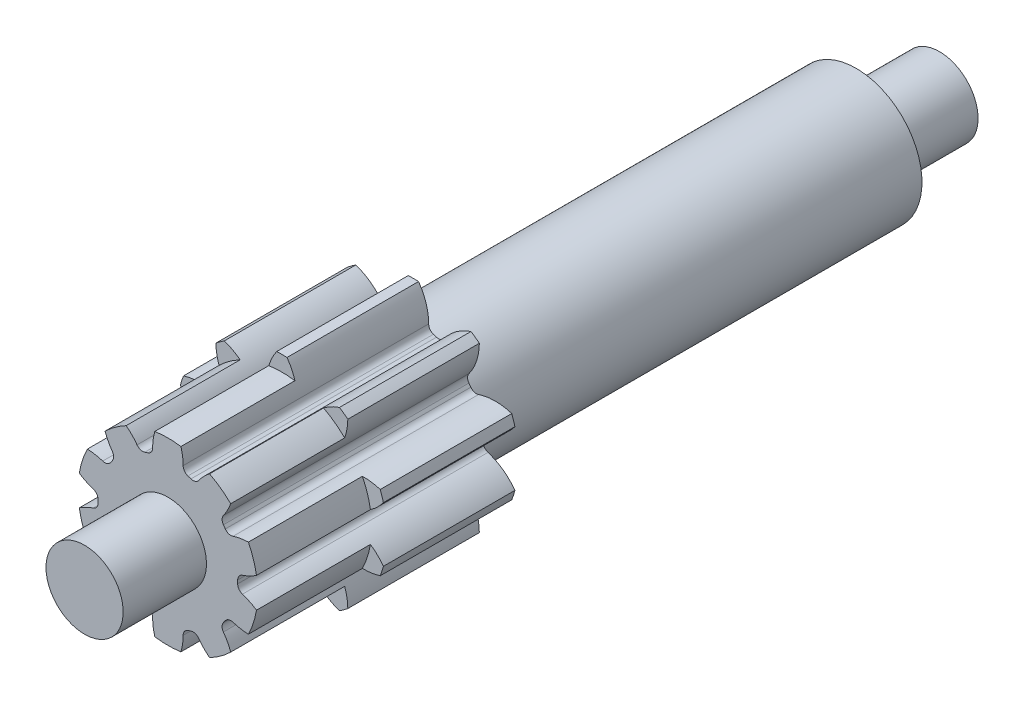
SolidWorks part; units mm, degrees
ref_plane "Front Plane" through (0, 0, 0) normal (0, 0, 1) x (1, 0, 0)
ref_plane "Top Plane" through (0, 0, 0) normal (0, 1, 0) x (1, 0, 0)
ref_plane "Right Plane" through (0, 0, 0) normal (1, 0, 0) x (0, 0, -1)
sketch "Sketch1" plane through (0, 0, 0) normal (0, 0, 1) x (1, 0, 0)
  line L0 (0, 0) -> (0, 1) construction
  line L1 (-0.3214, 1.117) -> (0.3214, 0.883) construction
  circle A0 centre (0, 0) radius 0.8 construction
  circle A1 centre (0, 0) radius 1.2 construction
  circle A2 centre (0, 0) radius 1 construction
  circle A3 centre (0, 0) radius 0.9397 construction
  circle A5 centre (0, 0) radius 0.5 construction
  point P8 (0.1, 0)
  point P13 (5, 0)
sketch "Sketch2" plane through (0, 0, 0) normal (1, 0, 0) x (0, 0, -1)
  line L0 (-4.875, 0) -> (4.875, 0) construction
  line L1 (4.875, 1.2) -> (4.875, -1.2) construction
  line L3 (-4.875, 1.2) -> (4.875, 1.2) construction
  line L5 (-4.875, 12.5) -> (-4.875, -12.5) construction
  point P2 (0, 1.2)
  dimension "Overall Width" = 9.75
  dimension "Face Width" = 4.875
sketch "Sketch3" plane through (0, 0, 0) normal (0, 0, 1) x (1, 0, 0)
  circle A0 centre (0, 0) radius 1.2
  circle A1 centre (0, 0) radius 1.2 construction
extrude "Boss-Extrude1" add sketch "Sketch3" against normal up to vertex (4.875 mm away) and the other way up to vertex (4.875 mm away)
sketch "Sketch4" plane through (0, 0, 0) normal (0, 0, 1) x (1, 0, 0)
  line L0 (0.7961, -0.0785) -> (0.7961, 0.0785)
  arc A3 (1.1581, 0.3145) -> (1.1581, -0.3145) centre (0, 0) cw
  circle A4 centre (0, 0) radius 1.2 construction
  arc A5 (1.1581, 0.3145) -> (0.7961, 0.0785) centre (0.6623, 0.6793) cw
  circle A6 centre (0, 0) radius 0.8 construction
  arc A7 (1.1581, -0.3145) -> (0.7961, -0.0785) centre (0.6623, -0.6793) ccw
  spline S0 degree 4 poles (0.9302, 0.1332) (0.9306, 0.1332) (0.9319, 0.1334) (0.9341, 0.1339) (0.9378, 0.1349) (0.9425, 0.1363) (0.9484, 0.1382) (0.9553, 0.1409) (0.9629, 0.144) (0.971, 0.1477) (0.979, 0.1517) (0.9868, 0.1559) (0.9946, 0.1603) (1.0039, 0.1659) (1.0149, 0.1729) (1.0275, 0.1817) (1.0414, 0.1921) (1.0554, 0.2034) (1.0688, 0.215) (1.082, 0.2273) (1.0945, 0.2396) (1.1072, 0.2528) (1.1187, 0.2654) (1.1311, 0.28) (1.1411, 0.2921) (1.1562, 0.3118) (1.1625, 0.3205) (1.1719, 0.3338) (1.1749, 0.3384) knots 0 0 0 0 0 0.005377 0.015084 0.028532 0.04661 0.064855 0.092111 0.119476 0.146842 0.174209 0.201575 0.228941 0.256307 0.307035 0.361767 0.4165 0.471232 0.525964 0.580697 0.635429 0.690161 0.744894 0.799626 0.854358 0.909091 1 1 1 1 1 construction
  spline S1 degree 4 poles (0.9302, 0.1332) (0.9306, 0.1332) (0.9319, 0.1334) (0.9341, 0.1339) (0.9378, 0.1349) (0.9425, 0.1363) (0.9484, 0.1382) (0.9553, 0.1409) (0.9629, 0.144) (0.971, 0.1477) (0.979, 0.1517) (0.9868, 0.1559) (0.9946, 0.1603) (1.0039, 0.1659) (1.0149, 0.1729) (1.0275, 0.1817) (1.0414, 0.1921) (1.0554, 0.2034) (1.0688, 0.215) (1.082, 0.2273) (1.0945, 0.2396) (1.1072, 0.2528) (1.1187, 0.2654) (1.1311, 0.28) (1.1411, 0.2921) (1.1508, 0.3048) (1.1556, 0.3112) (1.1581, 0.3145) knots 0 0 0 0 0 0.005377 0.015084 0.028532 0.04661 0.064855 0.092111 0.119476 0.146842 0.174209 0.201575 0.228941 0.256307 0.307035 0.361767 0.4165 0.471232 0.525964 0.580697 0.635429 0.690161 0.744894 0.799626 0.854358 0.909091 0.909091 0.909091 0.909091 0.909091 construction
  spline S2 degree 4 poles (0.9302, -0.1332) (0.9306, -0.1332) (0.9319, -0.1334) (0.9341, -0.1339) (0.9378, -0.1349) (0.9425, -0.1363) (0.9484, -0.1382) (0.9553, -0.1409) (0.9629, -0.144) (0.971, -0.1477) (0.979, -0.1517) (0.9868, -0.1559) (0.9946, -0.1603) (1.0039, -0.1659) (1.0149, -0.1729) (1.0275, -0.1817) (1.0414, -0.1921) (1.0554, -0.2034) (1.0688, -0.215) (1.082, -0.2273) (1.0945, -0.2396) (1.1072, -0.2528) (1.1187, -0.2654) (1.1311, -0.28) (1.1411, -0.2921) (1.1562, -0.3118) (1.1625, -0.3205) (1.1719, -0.3338) (1.1749, -0.3384) knots 0 0 0 0 0 0.005377 0.015084 0.028532 0.04661 0.064855 0.092111 0.119476 0.146842 0.174209 0.201575 0.228941 0.256307 0.307035 0.361767 0.4165 0.471232 0.525964 0.580697 0.635429 0.690161 0.744894 0.799626 0.854358 0.909091 1 1 1 1 1 construction
  spline S3 degree 4 poles (0.9302, -0.1332) (0.9306, -0.1332) (0.9319, -0.1334) (0.9341, -0.1339) (0.9378, -0.1349) (0.9425, -0.1363) (0.9484, -0.1382) (0.9553, -0.1409) (0.9629, -0.144) (0.971, -0.1477) (0.979, -0.1517) (0.9868, -0.1559) (0.9946, -0.1603) (1.0039, -0.1659) (1.0149, -0.1729) (1.0275, -0.1817) (1.0414, -0.1921) (1.0554, -0.2034) (1.0688, -0.215) (1.082, -0.2273) (1.0945, -0.2396) (1.1072, -0.2528) (1.1187, -0.2654) (1.1311, -0.28) (1.1411, -0.2921) (1.1508, -0.3048) (1.1556, -0.3112) (1.1581, -0.3145) knots 0 0 0 0 0 0.005377 0.015084 0.028532 0.04661 0.064855 0.092111 0.119476 0.146842 0.174209 0.201575 0.228941 0.256307 0.307035 0.361767 0.4165 0.471232 0.525964 0.580697 0.635429 0.690161 0.744894 0.799626 0.854358 0.909091 0.909091 0.909091 0.909091 0.909091 construction
extrude "Cut-Extrude1" cut sketch "Sketch4" against normal through all both and the other way through all
fillet "Fillet1" radius 0.0785 2 edges at (0.7961, -0.0785, 0) (0.7961, 0.0785, 0)
pattern_circular "CirPattern1" count 10 over 360 about axis through (0, 0, 0) along (0, 0, 1) of "Cut-Extrude1", "Fillet1"
sketch "Sketch6" plane through (0, 0, 0) normal (0, 1, 0) x (1, 0, 0)
  line L0 (0, 6.2826) -> (0, -4.2534) construction
  line L1 (0, 4.875) -> (0, -4.875) construction
  line L2 (-0.44, 4.875) -> (-1.3, 4.875)
  line L3 (-1.3, 4.875) -> (-1.3, -1.125)
  line L4 (-1.3, -1.125) -> (-0.75, -1.125)
  line L5 (-0.75, -1.125) -> (-0.75, 3.925)
  line L6 (-0.75, 3.925) -> (-0.44, 3.925)
  line L7 (-0.44, 3.925) -> (-0.44, 4.875)
  line L8 (0.0587, 4.875) -> (-0.0587, 4.875) construction
  line L9 (-1.3, -2.625) -> (-1.3, -4.875)
  line L10 (-1.3, -4.875) -> (-0.44, -4.875)
  line L11 (-0.44, -4.875) -> (-0.44, -3.925)
  line L12 (-0.44, -3.925) -> (-1.025, -3.925)
  line L13 (-1.025, -3.925) -> (-1.025, -2.625)
  line L14 (-1.025, -2.625) -> (-1.3, -2.625)
  line L15 (0.0587, -4.875) -> (0.1741, -4.875) construction
  dimension "D1" = 0.88
  dimension "D2" = 1.5
  dimension "D3" = 2.6
  dimension "D4" = 6
  dimension "D5" = 0.95
  dimension "D6" = 2.05
  dimension "D7" = 1.5
  dimension "D8" = 0.95
revolve "Cut-Revolve1" cut sketch "Sketch6" angle 360 about L0
equation "\"Number of Teeth\"= 10"
equation "\"Module\"= 0.2"
equation "\"Diametral Pitch\"= 1 / \"Module\""
equation "\"Dedendum\"= 1.25 / \"Diametral Pitch\""
equation "\"Pitch Diameter\"= \"Module\" * \"Number of Teeth\""
equation "\"Root Diameter\"= \"Pitch Diameter\" - ( 2 * \"Dedendum\" ) + 0.1"
equation "\"Root Diameter@Sketch1\"=\"Root Diameter\""
equation "\"OD@Sketch1\" = \"Outside Diameter\""
equation "\"D1@CirPattern1\"=\"Number of Teeth\""
equation "\"Pressure Angle\"= 20"
equation "\"Base Diameter\"= \"Pitch Diameter\" * cos ( \"Pressure Angle\" )"
equation "\"Outside Diameter\"= ( \"Number of Teeth\" + 2 ) / \"Diametral Pitch\""
equation "\"Pitch Angle\"= 360deg / \"Number of Teeth\""
equation "\"Alpha\"= sqr ( \"Pitch Diameter\" ^ 2 - \"Base Diameter\" ^ 2 ) / \"Base Diameter\" * 180 / PI - \"Pressure Angle\""
equation "\"Beta\"= ( \"Pitch Angle\" / 4 - \"Alpha\" )"
equation "\"Phi\"= sqr ( ( \"Outside Diameter\" / 2 ) ^ 2 - ( \"Base Diameter\" / 2 ) ^ 2 ) / ( \"Base Diameter\" / 2 )"
equation "\"Addendum\"= 1 / \"Diametral Pitch\""
equation "\"WorkingDepth\"= 2 / \"Diametral Pitch\""
equation "\"WholeDepth\"= 2.25 / \"Diametral Pitch\""
equation "\"Clearance\"= 0.25 / \"Diametral Pitch\""
equation "\"ToothThickness\"= ( pi * 2 ) / \"Diametral Pitch\""
equation "\"CircularPitch\"= pi / \"Diametral Pitch\""
equation "\"Number of Teeth@Sketch1\"=\"Number of Teeth\""
equation "\"Module@Sketch1\"=\"Module\""
equation "\"Pressure Angle@Sketch1\"=\"Pressure Angle\""
equation "\"Gear Pitch Diameter@Sketch1\"=\"Pitch Diameter\""
equation "\"Base Diameter@Sketch1\"=\"Base Diameter\""
equation "\"Fillet\"= \"Clearance\" * cos ( \"Pressure Angle\" ) * tan ( ( 90 + \"Pressure Angle\" ) / 2 )"
equation "\"D1\"= \"Fillet\""
equation "\"D1\"= \"Set Screw Pitch@Sketch1\" * .75"
equation "\"D1\"= \"Set Screw Diameter@Sketch1\" / 2"
equation "\"D3\"= \"Set Screw Pitch@Sketch1\" +  ( \"Hub Diameter@Sketch1\" / 2 ) "
equation "\"D4\"= \"Set Screw Pitch@Sketch1\""
equation "\"D2\"= \"Fillet\" * 2"
equation "\"D1\"= \"Fillet\" * 2"
equation "\"D1@Sketch4\"=\"CircularPitch\"*0.25"
equation "\"D1@Fillet1\"=\"CircularPitch\"*0.125"
